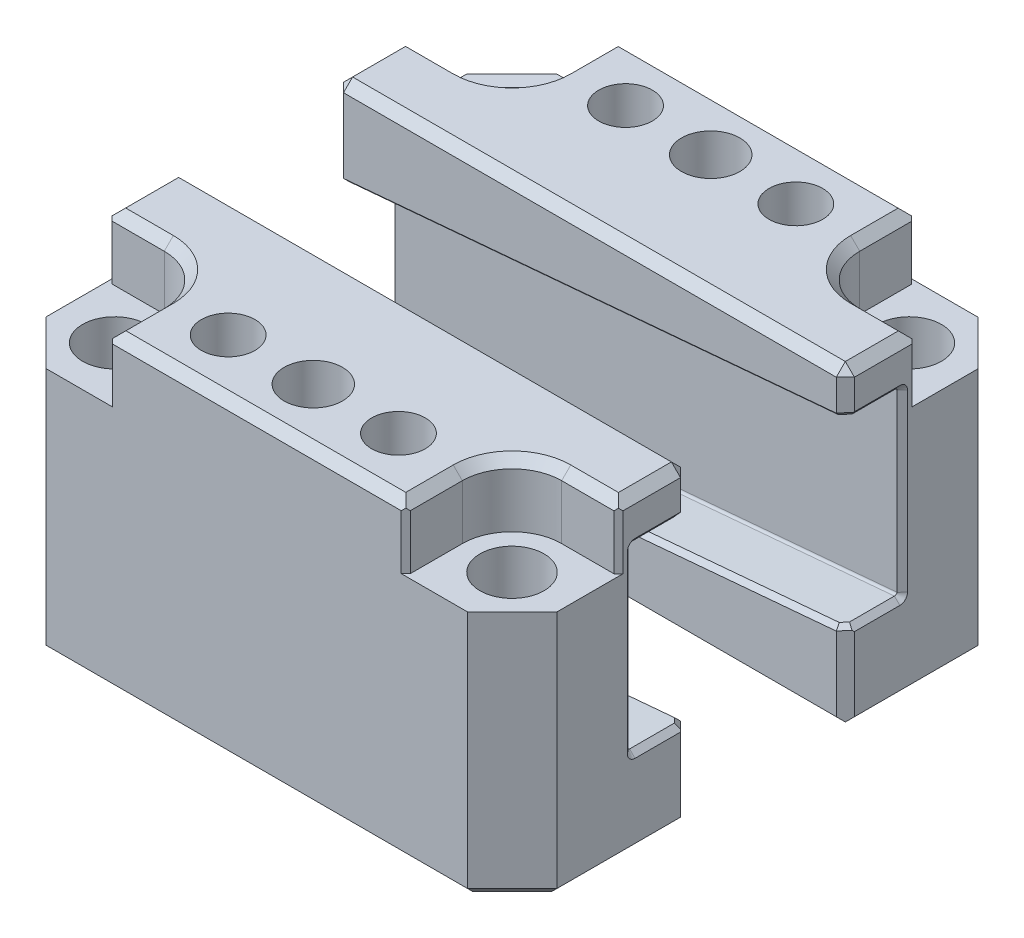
SolidWorks part; units mm, degrees
ref_plane "Front Plane" through (0, 0, 0) normal (0, 0, 1) x (1, 0, 0)
ref_plane "Top Plane" through (0, 0, 0) normal (0, 1, 0) x (1, 0, 0)
ref_plane "Right Plane" through (0, 0, 0) normal (1, 0, 0) x (0, 0, -1)
sketch "Sketch1" plane through (0, 0, 0) normal (1, 0, 0) x (0, 0, -1)
  line L0 (-8.7122, 0) -> (-8.7122, 34.925)
  line L1 (-8.7122, 34.925) -> (-28.5496, 34.925)
  line L2 (-28.5496, 34.925) -> (-28.5496, 0)
  line L3 (-28.5496, 0) -> (-8.7122, 0)
  line L4 (0, 48.255) -> (0, -16.2311) construction
  dimension "D1" = 17.4244
  dimension "D2" = 34.925
  dimension "D3" = 57.0992
  dimension "D4" = 19.8374
extrude "Boss-Extrude1" add sketch "Sketch1" along normal mid plane 57.15
hole_wizard "CBORE for 1/4 Socket Head Cap Screw1" positions "Sketch4" profile "Sketch3" counterbore size "1/4" standard "ANSI Inch"
sketch "Sketch4" plane through (0, 34.925, 0) normal (0, 1, 0) x (1, 0, 0)
  line L0 (0, 7.4267) -> (0, -36.2312) construction
  line L2 (-19.6518, 0) -> (14.0148, 0) construction
  point P0 (-22.225, -22.225)
  point P11 (22.225, -22.225)
  dimension "D1" = 44.45
  dimension "D2" = 44.45
sketch "Sketch3" plane through (-22.225, 34.925, 22.225) normal (1, 0, 0) x (0, 0, 1)
  line L0 (0, 0) -> (0, 34.925)
  line L1 (0, 34.925) -> (3.5712, 34.925)
  line L3 (3.5712, 34.925) -> (3.5712, 7.112)
  line L4 (3.5712, 7.112) -> (5.5562, 7.112)
  line L5 (5.5562, 7.112) -> (5.5562, 0)
  line L7 (5.5562, 0) -> (0, 0)
  line L11 (0, -6.35) -> (0, 107.95) construction
  dimension "Thru Hole Dia." = 7.1425
  dimension "Thru Hole Depth" = 34.925
  dimension "C'Bore Dia." = 11.1125
  dimension "C'Bore Depth" = 7.112
hole_wizard "5/16-18 Tapped Hole1" positions "Sketch6" profile "Sketch5" tap size "5/16-18" standard "ANSI Inch"
sketch "Sketch6" plane through (0, 34.925, 0) normal (0, 1, 0) x (1, 0, 0)
  line L0 (0, 2.7703) -> (0, -32.9614) construction
  line L2 (-8.3627, 0) -> (4.6629, 0) construction
  line L4 (22.225, -22.225) -> (-22.225, -22.225) construction
  point P2 (0, -22.225)
sketch "Sketch5" plane through (0, 34.925, 22.225) normal (1, 0, 0) x (0, 0, 1)
  line L0 (0, 0) -> (0, 25.4053)
  line L1 (0, 25.4053) -> (3.2639, 23.4442)
  line L2 (3.2639, 23.4442) -> (3.2639, 0)
  line L5 (3.2639, 0) -> (0, 0)
  line L10 (0, 25.4053) -> (-3.2639, 23.4442) construction
  line L11 (0, -6.35) -> (0, 107.95) construction
  dimension "Tap Drill Dia." = 6.5278
  dimension "Tap Drill Depth" = 23.4442
  dimension "Drill Angle" = 118
ref_plane "Plane3" through (0, 0, 22.225) normal (0, 0, 1) x (1, 0, 0)
sketch "Sketch17" plane through (0, 0, 22.225) normal (0, 0, 1) x (1, 0, 0)
  line L0 (-9.525, 38.4823) -> (-9.525, -4.3993) construction
  line L1 (-6.35, 0) -> (-6.35, 12.7)
  line L2 (28.575, 0) -> (-28.575, 0) construction
  line L3 (-6.35, 12.7) -> (-6.525, 12.8052)
  line L4 (-6.525, 12.8052) -> (-6.525, 34.925)
  line L5 (28.575, 34.925) -> (-28.575, 34.925) construction
  line L6 (-6.525, 34.925) -> (-9.525, 34.925)
  line L7 (-9.525, 34.925) -> (-9.525, 0)
  line L8 (-9.525, 0) -> (-6.35, 0)
  dimension "D1" = 9.525
  dimension "D2" = 12.7
  dimension "D3" = 6.35
  dimension "D4" = 6
  dimension "D5" = 59
revolve "Cut-Revolve2" cut sketch "Sketch17" angle 360 about L0
mirror "Mirror1" about plane through (0, 0, 0) normal (1, 0, 0) of "Cut-Revolve2"
sketch "Sketch8" plane through (0, 34.925, 0) normal (0, 1, 0) x (1, 0, 0)
  line L0 (0, 3.563) -> (0, -34.4411) construction
  line L2 (-28.575, -28.5496) -> (-16.6687, -28.5496)
  line L3 (28.575, -28.5496) -> (-28.575, -28.5496) construction
  line L4 (-16.6687, -28.5496) -> (-16.6687, -22.225)
  line L5 (-22.225, -16.6687) -> (-28.575, -16.6687)
  line L6 (-28.575, -8.7122) -> (-28.575, -28.5496) construction
  line L7 (-28.575, -16.6687) -> (-28.575, -28.5496)
  line L8 (28.575, -16.6687) -> (28.575, -28.5496)
  line L9 (22.225, -16.6687) -> (28.575, -16.6687)
  line L10 (16.6688, -28.5496) -> (16.6687, -22.225)
  line L11 (28.575, -28.5496) -> (16.6688, -28.5496)
  circle A0 centre (-22.225, -22.225) radius 5.5562 construction
  circle A1 centre (-22.225, -22.225) radius 5.5562 construction
  arc A2 (-16.6687, -22.225) -> (-22.225, -16.6687) centre (-22.225, -22.225) ccw
  arc A3 (16.6687, -22.225) -> (22.225, -16.6687) centre (22.225, -22.225) cw
extrude "Cut-Extrude3" cut sketch "Sketch8" against normal up to surface (7.112 mm away)
chamfer "Chamfer1" distance 5 angle 45 2 edges at (28.575, 13.9065, 28.5496) (-28.575, 13.9065, 28.5496)
sketch "Sketch9" plane through (0, 0, 8.7122) normal (0, 0, -1) x (-1, 0, 0)
  line L0 (0, 34.925) -> (0, 0) construction
  line L1 (-28.575, 34.925) -> (28.575, 34.925) construction
  line L2 (28.575, 0) -> (28.575, 34.925) construction
  line L3 (-28.575, 30.0071) -> (28.575, 25.0071)
  line L4 (-28.575, 30.0071) -> (-28.575, 9.9179)
  line L5 (-28.575, 9.9179) -> (28.575, 4.9179)
  line L6 (28.575, 25.0071) -> (28.575, 4.9179)
  line L7 (-28.575, 30.0071) -> (28.575, 4.9179) construction
  line L8 (-28.575, 9.9179) -> (28.575, 25.0071) construction
  line L9 (-32.1126, 17.4625) -> (21.456, 17.4625) construction
  point P5 (0, 17.4625)
  dimension "D1" = 20.0127
  dimension "D2" = 5
extrude "Cut-Extrude4" cut sketch "Sketch9" against normal offset from surface (6.35 mm away) 15.0622
hole_wizard "5/16-18 Tapped Hole2" positions "Sketch11" profile "Sketch10" tap size "5/16-18" standard "ANSI Inch"
sketch "Sketch11" plane through (0, 0, 0) normal (0, -1, 0) x (-1, 0, 0)
  point P0 (22.225, -22.225)
  point P3 (-22.225, -22.225)
sketch "Sketch10" plane through (-22.225, 0, 22.225) normal (1, 0, 0) x (0, 0, -1)
  line L0 (0, 0) -> (0, 34.925)
  line L1 (0, 34.925) -> (3.5814, 34.925)
  line L2 (3.5814, 34.925) -> (3.5814, 0)
  line L5 (3.5814, 0) -> (0, 0)
  line L11 (0, -6.35) -> (0, 107.95) construction
  dimension "Thru Tap Drill Dia." = 7.1628
  dimension "Thru Tap Drill Depth" = 34.925
ref_plane "Plane1" through (-1.5162, 17.3299, 0) normal (0.0872, -0.9962, 0) x (-0.9962, -0.0872, 0)
fillet "Fillet1" radius 0.254 2 edges at (0, 7.4179, 15.0622) (0, 27.5071, 15.0622)
chamfer "Chamfer2" distance 1.016 angle 45 6 edges at (0, 0, 8.7122) (-28.575, 0, 16.1309) (-26.075, 0, 26.0496) (0, 0, 28.5496) (26.075, 0, 26.0496) (28.575, 0, 16.1309)
chamfer "Chamfer3" distance 1.016 angle 45 14 edges at (-18.2961, 34.925, 18.2961) (-28.575, 34.925, 12.6905) (0, 34.925, 8.7122) (28.575, 34.925, 12.6905) (18.2961, 34.925, 18.2961) (0, 34.925, 28.5496) (28.575, 5.467, 8.7122) (-28.575, 2.967, 8.7122) (28.575, 32.466, 8.7122) (-28.575, 29.966, 8.7122) (-16.6687, 34.925, 25.3873) (-25.4, 34.925, 16.6688) (16.6687, 34.925, 25.3873) (25.4, 34.925, 16.6688)
chamfer "Chamfer4" distance 0.508 angle 45 4 edges at (28.575, 30.861, 16.6688) (16.6688, 30.861, 28.5496) (-16.6687, 30.861, 28.5496) (-28.575, 30.861, 16.6688)
chamfer "Chamfer5" distance 0.508 angle 45 16 edges at (28.575, 9.9179, 12.2682) (28.575, 19.9625, 15.0622) (28.575, 30.0071, 12.2682) (0, 7.4179, 8.7122) (-28.575, 4.9179, 12.2682) (-28.575, 14.9625, 15.0622) (-28.575, 25.0071, 12.2682) (0, 27.5071, 8.7122) (28.067, 9.8735, 9.2202) (-28.067, 4.9624, 9.2202) (-28.067, 25.0515, 9.2202) (28.067, 29.9626, 9.2202) (28.575, 9.9926, 14.9878) (28.575, 29.9324, 14.9878) (-28.575, 4.9926, 14.9878) (-28.575, 24.9324, 14.9878)
ref_plane "Plane2" through (19.05, 0, 0) normal (1, 0, 0) x (0, 0, -1)
sketch "Sketch18" plane through (19.05, 0, 0) normal (1, 0, 0) x (0, 0, -1)
  line L0 (-12.7, 0) -> (-12.7, 6.2637) construction
  line L1 (-9.7282, 0) -> (-23.1288, 0) construction
  line L2 (-12.7, 4.93) -> (-11.2, 4.064)
  line L3 (-11.2, 4.064) -> (-11.2, 0)
  line L4 (-11.2, 0) -> (-12.7, 0)
  line L5 (-12.7, 0) -> (-12.7, 4.93)
  line L6 (-22.225, 12.2237) -> (-22.225, -12.2237) construction
  dimension "D1" = 3
  dimension "D2" = 9.525
  dimension "D3" = 60
  dimension "D4" = 4.064
revolve "Cut-Revolve3" cut sketch "Sketch18" angle 360 about L0
chamfer "Chamfer6" distance 0.508 angle 45 2 edges at (-12.7, 0, 22.225) (12.7, 0, 22.225)
mirror "Mirror2" about plane through (0, 0, 0) normal (0, 0, 1)
